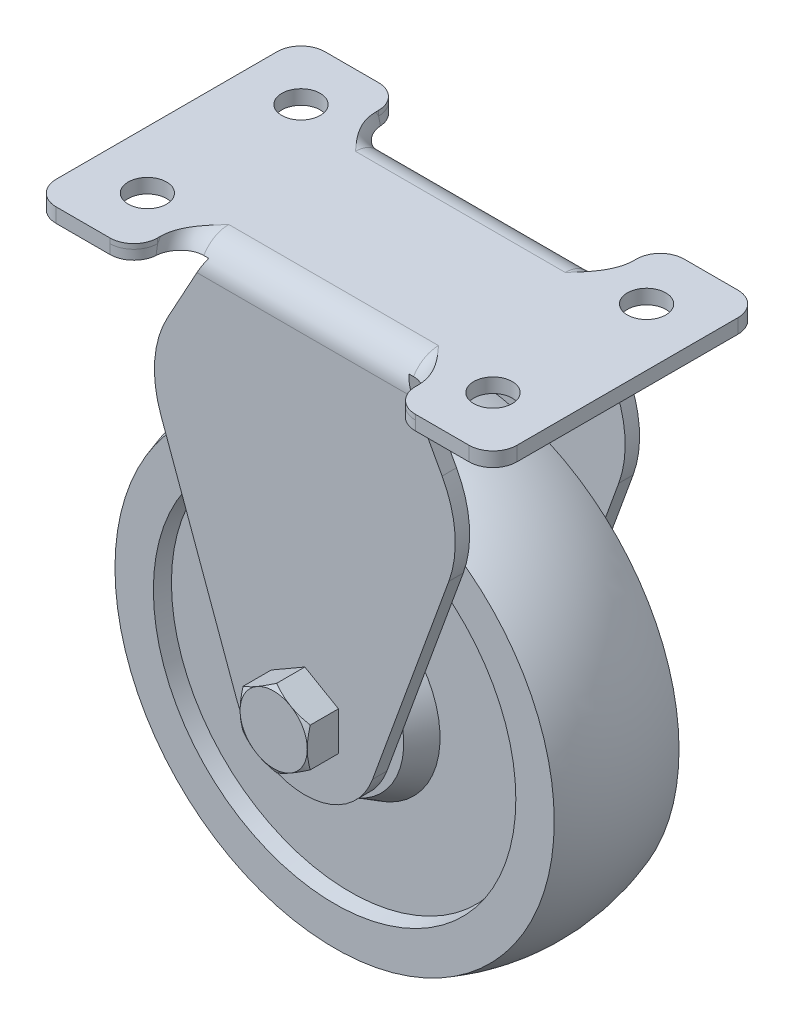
SolidWorks part; units mm, degrees
ref_plane "Front Plane" through (0, 0, 0) normal (0, 0, 1) x (1, 0, 0)
ref_plane "Top Plane" through (0, 0, 0) normal (0, 1, 0) x (1, 0, 0)
ref_plane "Right Plane" through (0, 0, 0) normal (1, 0, 0) x (0, 0, -1)
sketch "Sketch1" plane through (0, 0, 0) normal (0, 0, 1) x (1, 0, 0)
  line L0 (0, 0) -> (0, -96.8375)
  line L1 (-38.1, 0) -> (38.1, 0)
  line L2 (-38.1, 0) -> (-38.1, -2.3813)
  line L3 (-38.1, -2.3813) -> (38.1, -2.3812)
  line L4 (38.1, 0) -> (38.1, -2.3812)
  circle A0 centre (0, -58.7375) radius 38.1
sketch "Sketch2" plane through (0, 0, 0) normal (1, 0, 0) x (0, 0, -1)
  line L0 (-10.3187, -58.7375) -> (10.3187, -58.7375)
  line L1 (-10.3187, -20.6375) -> (10.3187, -20.6375)
  line L2 (-10.3187, -20.6375) -> (-10.3187, -96.8375)
  line L3 (-10.3187, -96.8375) -> (10.3187, -96.8375)
  line L4 (10.3187, -20.6375) -> (10.3187, -96.8375)
  dimension "Wheel Width" = 20.6375
sketch "Sketch3" plane through (0, 0, 0) normal (1, 0, 0) x (0, 0, -1)
  line L0 (-11.5887, -58.7375) -> (-11.5887, -46.0375)
  line L1 (-11.5887, -46.0375) -> (-7.7787, -43.8378)
  line L2 (-7.7787, -43.8378) -> (-7.7787, -29.2134)
  line L3 (-7.7787, -29.2134) -> (-10.3187, -28.7655)
  line L4 (-10.3187, -28.7655) -> (-10.3187, -22.4155)
  line L6 (-10.3187, -20.6375) -> (10.3187, -20.6375) construction
  line L7 (-11.5887, -58.7375) -> (11.5887, -58.7375)
  line L8 (11.5887, -58.7375) -> (11.5887, -46.0375)
  line L9 (11.5887, -46.0375) -> (7.7787, -43.8378)
  line L10 (7.7787, -43.8378) -> (7.7787, -29.2134)
  line L11 (7.7787, -29.2134) -> (10.3187, -28.7655)
  line L12 (10.3187, -28.7655) -> (10.3187, -22.4155)
  line L14 (0, -20.6375) -> (0, -96.8375) construction
  line L15 (-10.3187, -20.6375) -> (-10.3187, -96.8375) construction
  line L16 (10.3187, -20.6375) -> (10.3187, -96.8375) construction
  line L19 (-11.5887, -58.7375) -> (-12.8588, -58.7375) construction
  line L21 (-12.8588, -58.7375) -> (-15.24, -58.7375) construction
  line L22 (11.5887, -58.7375) -> (12.8588, -58.7375) construction
  line L23 (12.8588, -58.7375) -> (15.24, -58.7375) construction
  arc A0 (-10.3187, -22.4155) -> (10.3187, -22.4155) centre (0, -51.4693) cw
revolve "Revolve1" add sketch "Sketch3" angle 360 about L19
sketch "Sketch4" plane through (0, 0, 0) normal (0, 1, 0) x (1, 0, 0)
  line L0 (-38.1, 22.225) -> (38.1, -22.225) construction
  line L1 (-34.1376, 22.225) -> (34.1376, 22.225)
  line L2 (-38.1, 18.2626) -> (-38.1, -18.2626)
  line L3 (-34.1376, -22.225) -> (34.1376, -22.225)
  line L4 (38.1, 18.2626) -> (38.1, -18.2626)
  line L8 (0, 0) -> (0, 22.225) construction
  line L9 (0, 0) -> (38.1, 0) construction
  circle A0 centre (-28.575, 12.7) radius 3.175
  circle A1 centre (-28.575, -12.7) radius 3.175
  circle A2 centre (28.575, -12.7) radius 3.175
  circle A3 centre (28.575, 12.7) radius 3.175
  arc A4 (-38.1, -18.2626) -> (-34.1376, -22.225) centre (-34.1376, -18.2626) ccw
  arc A5 (34.1376, -22.225) -> (38.1, -18.2626) centre (34.1376, -18.2626) ccw
  arc A6 (34.1376, 22.225) -> (38.1, 18.2626) centre (34.1376, 18.2626) cw
  arc A7 (-34.1376, 22.225) -> (-38.1, 18.2626) centre (-34.1376, 18.2626) ccw
  point P24 (38.1, 22.225)
  dimension "D3" = 6.35
  dimension "D4" = 3.9624
  dimension "Plate Width" = 44.45
  dimension "A" = 57.15
  dimension "B" = 25.4
extrude "Boss-Extrude1" add sketch "Sketch4" against normal up to vertex separate body
sketch "Sketch7" plane through (0, 0, 0) normal (0, 0, 1) x (1, 0, 0)
  line L0 (-11.1942, -62.8118) -> (-23.8097, -28.1511)
  line L1 (0, -52.3217) -> (-5.5562, -55.5296)
  line L2 (-5.5562, -55.5296) -> (-5.5562, -61.9454)
  line L3 (-5.5562, -61.9454) -> (0, -65.1533)
  line L4 (0, -65.1533) -> (5.5562, -61.9454)
  line L5 (5.5562, -61.9454) -> (5.5563, -55.5296)
  line L6 (5.5563, -55.5296) -> (0, -52.3217)
  line L9 (23.8097, -28.1511) -> (11.1942, -62.8118)
  line L10 (-26.5444, -20.6375) -> (26.5444, -20.6375) construction
  line L11 (-22.7032, -13.6249) -> (-15.24, 0)
  line L12 (22.7032, -13.6249) -> (15.24, 0)
  line L13 (-15.24, 0) -> (15.24, 0)
  line L14 (0, 0) -> (0, -20.6375) construction
  circle A0 centre (0, -58.7375) radius 5.5563 construction
  arc A1 (-11.1942, -62.8118) -> (11.1942, -62.8118) centre (0, -58.7375) ccw
  circle A2 centre (0, -58.7375) radius 38.1 construction
  arc A3 (22.7032, -13.6249) -> (23.8097, -28.1511) centre (7.2123, -22.1101) cw
  arc A4 (-23.8097, -28.1511) -> (-22.7032, -13.6249) centre (-7.2123, -22.1101) cw
sketch "Sketch8" plane through (0, 0, 0) normal (0, 0, 1) x (1, 0, 0)
  line L1 (-38.1, 0) -> (38.1, 0)
  line L2 (-38.1, 0) -> (-38.1, -96.8375)
  line L3 (-38.1, -96.8375) -> (38.1, -96.8375)
  line L4 (38.1, 0) -> (38.1, -96.8375)
  line L5 (-38.1, -2.3812) -> (-38.1, 0) construction
extrude "Boss-Extrude3" add sketch "Sketch8" along normal mid plane 30.48 separate body
sketch "Sketch9" plane through (0, 0, 0) normal (0, 0, 1) x (1, 0, 0)
  line L0 (-11.1942, -62.8118) -> (-23.8097, -28.1511) construction
  line L1 (23.8097, -28.1511) -> (11.1942, -62.8118) construction
  line L2 (-11.1942, -62.8118) -> (-23.8097, -28.1511)
  line L3 (23.8097, -28.1511) -> (11.1942, -62.8118)
  line L4 (-22.7032, -13.6249) -> (-15.24, 0) construction
  line L5 (22.7032, -13.6249) -> (15.24, 0) construction
  line L6 (-22.7032, -13.6249) -> (-15.24, 0)
  line L7 (22.7032, -13.6249) -> (15.24, 0)
  arc A0 (-11.1942, -62.8118) -> (11.1942, -62.8118) centre (0, -58.7375) ccw construction
  arc A1 (-11.1942, -62.8118) -> (11.1942, -62.8118) centre (0, -58.7375) ccw
  arc A2 (-22.7032, -13.6249) -> (-23.8097, -28.1511) centre (-7.2123, -22.1101) ccw construction
  arc A3 (23.8097, -28.1511) -> (22.7032, -13.6249) centre (7.2123, -22.1101) ccw construction
  arc A4 (-22.7032, -13.6249) -> (-23.8097, -28.1511) centre (-7.2123, -22.1101) ccw
  arc A5 (23.8097, -28.1511) -> (22.7032, -13.6249) centre (7.2123, -22.1101) ccw
shell "Shell1"
sketch "Sketch14" plane through (0, 0, 0) normal (0, 0, 1) x (1, 0, 0)
  line L2 (-11.1942, -62.8118) -> (-23.8097, -28.1511) construction
  line L3 (-22.7032, -13.6249) -> (-15.24, 0) construction
  line L6 (22.7032, -13.6249) -> (15.24, 0) construction
  line L7 (23.8097, -28.1511) -> (11.1942, -62.8118) construction
  line L8 (-11.1942, -62.8118) -> (-23.8097, -28.1511)
  line L9 (-22.7032, -13.6249) -> (-15.24, 0)
  line L10 (22.7032, -13.6249) -> (15.24, 0)
  line L11 (23.8097, -28.1511) -> (11.1942, -62.8118)
  arc A0 (-11.1942, -62.8118) -> (11.1942, -62.8118) centre (0, -58.7375) ccw construction
  arc A1 (-11.1942, -62.8118) -> (11.1942, -62.8118) centre (0, -58.7375) ccw
  arc A4 (-22.7032, -13.6249) -> (-23.8097, -28.1511) centre (-7.2123, -22.1101) ccw construction
  arc A5 (23.8097, -28.1511) -> (22.7032, -13.6249) centre (7.2123, -22.1101) ccw construction
  arc A6 (-22.7032, -13.6249) -> (-23.8097, -28.1511) centre (-7.2123, -22.1101) ccw
  arc A7 (23.8097, -28.1511) -> (22.7032, -13.6249) centre (7.2123, -22.1101) ccw
extrude "Cut-Extrude4" cut sketch "Sketch14" against normal through all and the other way through all
sketch "Sketch19" plane through (0, 0, 15.24) normal (0, 0, 1) x (1, 0, 0)
  line L0 (-7.2123, -22.1101) -> (-21.3069, -2.3812) construction
  line L1 (7.2123, -22.1101) -> (21.3069, -2.3812) construction
  line L3 (-21.3069, -2.3812) -> (21.3069, -2.3812)
  line L4 (-21.3069, -2.3812) -> (-21.3069, 0)
  line L5 (-21.3069, 0) -> (21.3069, 0)
  line L6 (21.3069, -2.3812) -> (21.3069, 0)
  line L7 (-34.1376, -2.3812) -> (34.1376, -2.3812) construction
  line L8 (-34.1376, 0) -> (34.1376, 0) construction
  dimension "D1" = 4.7625
  dimension "D2" = 4.7625
extrude "Cut-Extrude8" cut sketch "Sketch19" along normal through all
mirror "Mirror2" about plane through (0, 0, 0) normal (0, 0, 1) of "Cut-Extrude8"
sketch "Sketch11" plane through (0, 0, 15.24) normal (0, 0, 1) x (1, 0, 0)
  line L0 (0, -65.1533) -> (5.5562, -61.9454) construction
  line L1 (-5.5562, -61.9454) -> (0, -65.1533) construction
  line L2 (-5.5562, -55.5296) -> (-5.5562, -61.9454) construction
  line L3 (0, -52.3217) -> (-5.5562, -55.5296) construction
  line L4 (5.5563, -55.5296) -> (0, -52.3217) construction
  line L5 (5.5562, -61.9454) -> (5.5563, -55.5296) construction
  line L6 (0, -65.1533) -> (5.5562, -61.9454)
  line L7 (-5.5562, -61.9454) -> (0, -65.1533)
  line L8 (-5.5562, -55.5296) -> (-5.5562, -61.9454)
  line L9 (0, -52.3217) -> (-5.5562, -55.5296)
  line L10 (5.5563, -55.5296) -> (0, -52.3217)
  line L11 (5.5562, -61.9454) -> (5.5563, -55.5296)
extrude "Boss-Extrude5" add sketch "Sketch11" along normal blind 5.1562 separate body
sketch "Sketch12" plane through (0, 0, 20.3962) normal (0, 0, 1) x (1, 0, 0)
  circle A0 centre (0, -58.7375) radius 5.5563 construction
  circle A1 centre (0, -58.7375) radius 5.5563
extrude "Cut-Extrude2" cut sketch "Sketch12" against normal through all draft 60 flip side to cut
mirror "Mirror1" about plane through (0, 0, 0) normal (0, 0, 1)
sketch "Sketch16" plane through (0, 0, -15.24) normal (0, 0, 1) x (1, 0, 0)
  circle A0 centre (0, -58.7375) radius 3.9688
  dimension "D1" = 7.9375
extrude "Boss-Extrude6" add sketch "Sketch16" along normal up to surface (35.6362 mm away)
sketch "Sketch18" plane through (0, -2.3812, 0) normal (0, -1, 0) x (1, 0, 0)
  line L0 (16.5444, -12.8587) -> (-16.5444, -12.8587) construction
  line L1 (38.1, -12.8587) -> (-38.1, -12.8588)
  line L2 (38.1, -12.8587) -> (38.1, 12.8587)
  line L3 (38.1, 12.8587) -> (-38.1, 12.8587)
  line L4 (-38.1, -12.8588) -> (-38.1, 12.8587)
  line L5 (16.5444, 12.8587) -> (-16.5444, 12.8587) construction
  line L7 (-38.1, -18.2626) -> (-38.1, 18.2626) construction
  line L8 (38.1, 18.2626) -> (38.1, -18.2626) construction
extrude "Cut-Extrude7" cut sketch "Sketch18" against normal through all
combine bodies "Combine1" operation type add bodies to combine 120 112 122
fillet "Fillet1" radius 4.7625 2 edges at (0, 0, -15.24) (0, 0, 15.24)
fillet "Fillet2" radius 2.3813 2 edges at (0, -2.3812, -12.8587) (0, -2.3812, 12.8588)
fillet "Fillet3" radius 3.9624 4 edges at (-21.3069, -0.6381, -12.8587) (21.3069, -0.6381, -12.8587) (21.3069, -0.6381, 12.8587) (-21.3069, -0.6381, 12.8587)
fillet "Fillet4" radius 3.9624 4 edges at (21.3069, -1.1906, -22.225) (21.3069, -1.1906, 22.225) (-21.3069, -1.1906, -22.225) (-21.3069, -1.1906, 22.225)
equation "\"D1@Boss-Extrude3\" = \"D14@Sketch3\""
equation "\"D3@Sketch7\" = \"Plate Length@Sketch1\"/2.50"
equation "\"D13@Sketch3\" = \"Leg Thickness@Shell1\""
equation "\"D6@Sketch7\" = \"D5@Sketch7\"/4"
equation "\"D1@Fillet2\" = \"D1@Fillet1\"-\"Leg Thickness@Shell1\""
